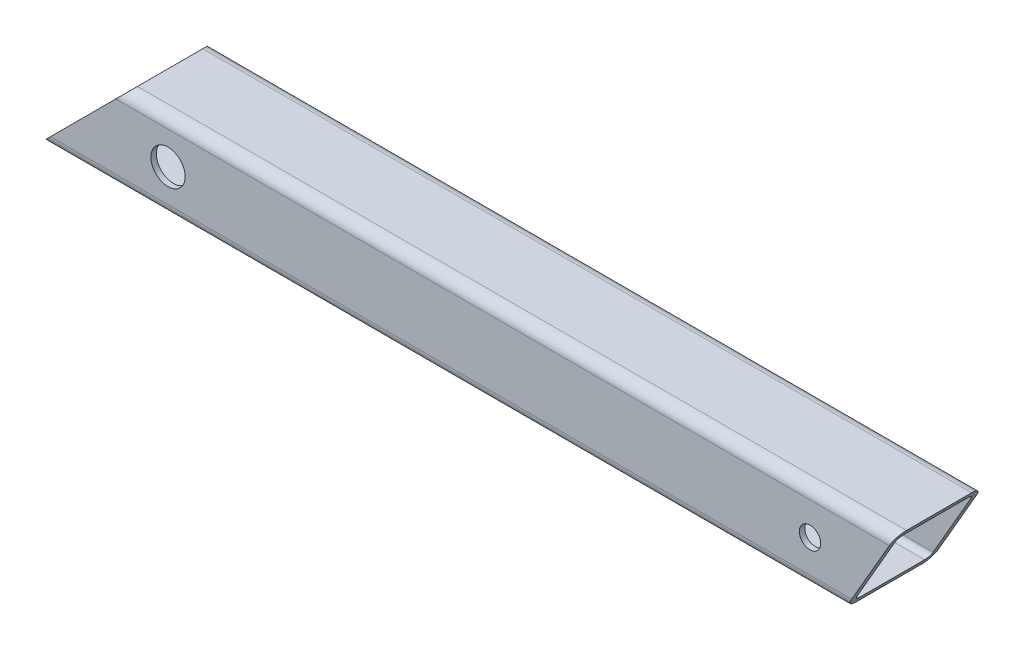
SolidWorks part; units mm, degrees
ref_plane "Front Plane" through (0, 0, 0) normal (0, 0, 1) x (1, 0, 0)
ref_plane "Top Plane" through (0, 0, 0) normal (0, 1, 0) x (1, 0, 0)
ref_plane "Right Plane" through (0, 0, 0) normal (1, 0, 0) x (0, 0, -1)
sketch "Member Sketch" plane through (0, 0, 0) normal (0, 1, 0) x (1, 0, 0)
  line L0 (0, 0) -> (1000, 0)
  line L2 (0, 0) -> (1000, 0) construction
other "Structural Member1"
ref_plane "Plane1" through (0, 0, 0) normal (1, 0, 0) x (0, 0, -1)
sketch "Sketch129" plane through (0, 0, 0) normal (1, 0, 0) x (0, 0, -1)
  line L0 (0, 50.8) -> (0, -50.8) construction
  line L1 (-50.8, 0) -> (50.8, 0) construction
  line L2 (-38.1, 50.8) -> (38.1, 50.8)
  line L3 (50.8, 38.1) -> (50.8, -38.1)
  line L4 (-50.8, 38.1) -> (-50.8, -38.1)
  line L5 (-38.1, -50.8) -> (38.1, -50.8)
  line L6 (-38.1, 44.45) -> (38.1, 44.45)
  line L7 (44.45, 38.1) -> (44.45, -38.1)
  line L8 (-38.1, -44.45) -> (38.1, -44.45)
  line L9 (-44.45, 38.1) -> (-44.45, -38.1)
  arc A0 (38.1, 50.8) -> (50.8, 38.1) centre (38.1, 38.1) cw
  arc A1 (-38.1, 50.8) -> (-50.8, 38.1) centre (-38.1, 38.1) ccw
  arc A2 (-38.1, -50.8) -> (-50.8, -38.1) centre (-38.1, -38.1) cw
  arc A3 (38.1, -50.8) -> (50.8, -38.1) centre (38.1, -38.1) ccw
  arc A4 (38.1, 44.45) -> (44.45, 38.1) centre (38.1, 38.1) cw
  arc A5 (38.1, -44.45) -> (44.45, -38.1) centre (38.1, -38.1) ccw
  arc A6 (-38.1, -44.45) -> (-44.45, -38.1) centre (-38.1, -38.1) cw
  arc A7 (-38.1, 44.45) -> (-44.45, 38.1) centre (-38.1, 38.1) ccw
  point P7 (0, 0)
  point P29 (-50.8, 50.8)
  point P30 (50.8, 50.8)
  point P31 (50.8, -50.8)
  point P32 (-50.8, -50.8)
  dimension "RO" = 12.7
  dimension "RI" = 6.35
  dimension "D" = 101.6
  dimension "B" = 101.6
  dimension "T" = 6.35
sketch "Sketch13" plane through (0, 0, 0) normal (0, 0, 1) x (1, 0, 0)
  line L0 (0, -50.8) -> (101.6, 50.8)
  line L1 (1000, 50.8) -> (0, 50.8) construction
  line L4 (0, 38.1) -> (0, -38.1) construction
  dimension "D1" = 45
extrude "Cut-Extrude2" cut sketch "Sketch13" against normal through all and the other way through all
sketch "Sketch14" plane through (0, 0, 0) normal (0, 0, 1) x (1, 0, 0)
  line L0 (1000, 50.8) -> (941.3412, -50.8)
  line L1 (1000, -50.8) -> (0, -50.8) construction
  line L2 (1000, 38.1) -> (1000, -38.1) construction
  dimension "D1" = 30
extrude "Cut-Extrude5" cut sketch "Sketch14" against normal through all and the other way through all
sketch "Sketch15" plane through (0, 0, 50.8) normal (0, 0, 1) x (1, 0, 0)
  line L0 (0, 0) -> (1000, 0) construction
  circle A0 centre (150, 0) radius 20
  circle A1 centre (900, 0) radius 12.5
  dimension "D1" = 40
  dimension "D2" = 25
  dimension "D3" = 100
  dimension "D4" = 150
extrude "Cut-Extrude6" cut sketch "Sketch15" against normal through all
